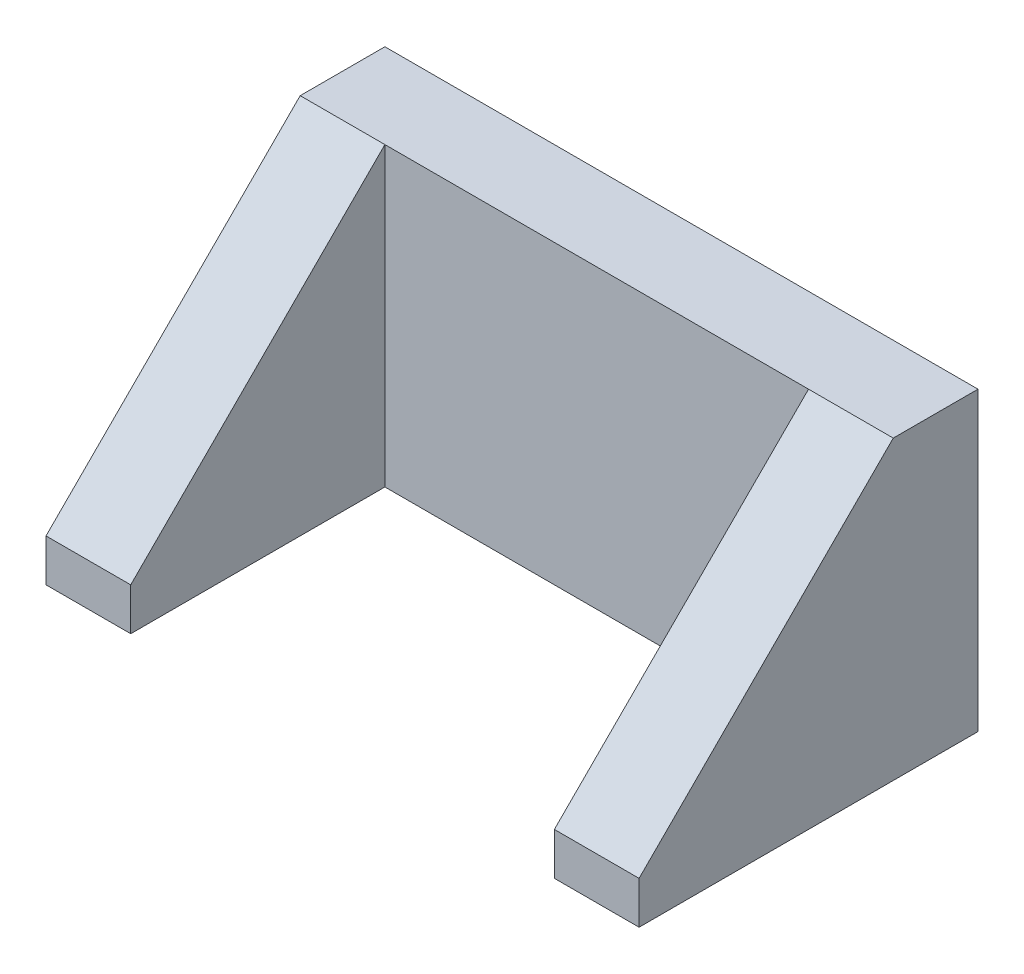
SolidWorks part; units mm, degrees
ref_plane "Front Plane" through (0, 0, 0) normal (0, 0, 1) x (1, 0, 0)
ref_plane "Top Plane" through (0, 0, 0) normal (0, 1, 0) x (1, 0, 0)
ref_plane "Right Plane" through (0, 0, 0) normal (1, 0, 0) x (0, 0, -1)
sketch "Sketch1" plane through (0, 0, 0) normal (0, 1, 0) x (1, 0, 0)
  line L0 (0, 0) -> (25.4, 0)
  line L1 (25.4, 0) -> (25.4, 152.4)
  line L2 (25.4, 152.4) -> (152.4, 152.4)
  line L3 (152.4, 152.4) -> (152.4, 0)
  line L4 (152.4, 0) -> (177.8, 0)
  line L5 (177.8, 0) -> (177.8, 177.8)
  line L6 (177.8, 177.8) -> (0, 177.8)
  line L7 (0, 177.8) -> (0, 0)
  dimension "D1" = 177.8
  dimension "D2" = 25.4
  dimension "D3" = 177.8
  dimension "D4" = 25.4
extrude "Boss-Extrude1" add sketch "Sketch1" along normal blind 12.7
sketch "Sketch2" plane through (0, 12.7, 0) normal (0, 1, 0) x (1, 0, 0)
  line L0 (177.8, 0) -> (177.8, 177.8) construction
  line L1 (0, 177.8) -> (177.8, 177.8)
  line L2 (0, 177.8) -> (0, 152.4)
  line L3 (0, 152.4) -> (177.8, 152.4)
  line L4 (177.8, 177.8) -> (177.8, 152.4)
  dimension "D1" = 25.4
extrude "Boss-Extrude2" add sketch "Sketch2" along normal blind 76.2
sketch "Sketch4" plane through (177.8, 0, 0) normal (1, 0, 0) x (0, 0, -1)
  line L0 (152.4, 88.9) -> (152.4, 12.7)
  line L1 (152.4, 12.7) -> (76.2, 12.7)
  line L2 (0, 12.7) -> (152.4, 12.7) construction
  line L3 (76.2, 12.7) -> (152.4, 88.9)
extrude "Boss-Extrude3" add sketch "Sketch4" against normal up to surface (25.4 mm away)
ref_plane "Plane1" through (88.9, 0, 0) normal (1, 0, 0) x (0, 0, -1)
mirror "Mirror1" about plane through (88.9, 0, 0) normal (1, 0, 0) of "Boss-Extrude3", "Boss-Extrude1"
sketch "Sketch5" plane through (0, 12.7, 0) normal (0, 1, 0) x (1, 0, 0)
  line L1 (0, 76.2) -> (177.8, 76.2)
  line L2 (0, 76.2) -> (0, 0)
  line L3 (0, 0) -> (177.8, 0)
  line L4 (177.8, 76.2) -> (177.8, 0)
extrude "Cut-Extrude1" cut sketch "Sketch5" against normal blind 76.2
